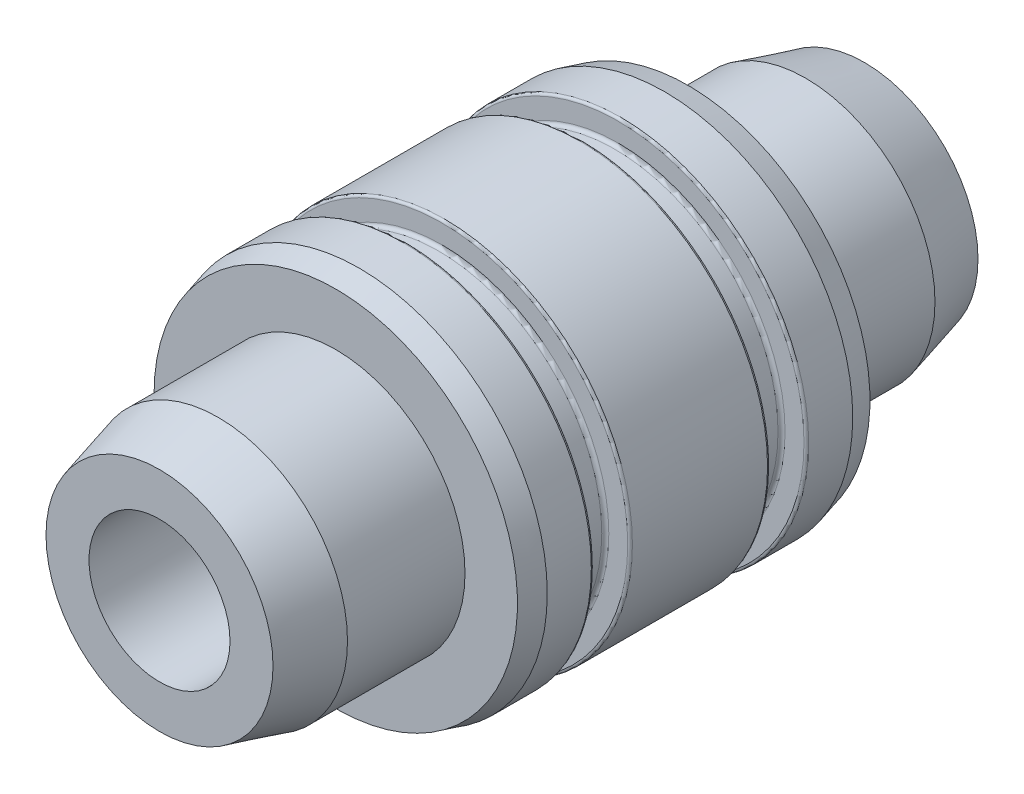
SolidWorks part; units mm, degrees
ref_plane "Face" through (0, 0, 0) normal (0, 0, 1) x (1, 0, 0)
ref_plane "Dessus" through (0, 0, 0) normal (0, 1, 0) x (1, 0, 0)
ref_plane "Profil" through (0, 0, 0) normal (1, 0, 0) x (0, 0, -1)
sketch "Esquisse1" plane through (0, 0, 0) normal (0, 0, 1) x (1, 0, 0)
  circle A0 centre (0, 0) radius 16
  dimension "D1" = 32
extrude "Extrusion1" add sketch "Esquisse1" along normal blind 15
sketch "Esquisse3" plane through (0, 0, 15) normal (0, 0, 1) x (1, 0, 0)
  circle A0 centre (0, 0) radius 11
  dimension "D1" = 22
extrude "Extrusion2" add sketch "Esquisse3" along normal blind 15
sketch "Esquisse4" plane through (0, 0, 30) normal (0, 0, 1) x (1, 0, 0)
  circle A0 centre (0, 0) radius 6
  dimension "D1" = 12
extrude "Enlèv. mat.-Extru.1" cut sketch "Esquisse4" against normal up to surface (15 mm away)
chamfer "Chanfrein1" distance 5 angle 15 1 edges at (11, 0, 30)
chamfer "Chanfrein2" distance 2 angle 15 1 edges at (16, 0, 15)
mirror "Symétrie5" about plane through (0, 0, 0) normal (0, 0, 1)
hole_wizard "Diamètre du perçage M8.0 (8.000000)1" positions "Esquisse3D1" profile "Esquisse5" hole size "M8.0" standard "ISO"
sketch3d "Esquisse3D1"
  circle A0 centre (0, 0, 30) radius 6 construction
  point P0 (0, 0, 15)
  point P8 (0, 0, 36)
sketch "Esquisse5" plane through (0, 0, 15) normal (1, 0, 0) x (0, -1, 0)
  line L0 (0, 0) -> (0, 45)
  line L1 (0, 45) -> (4, 45)
  line L2 (4, 45) -> (4, 0)
  line L5 (4, 0) -> (0, 0)
  line L11 (0, -6.35) -> (0, 107.95) construction
  dimension "Diamètre du perçage jusqu'au prochain" = 8
  dimension "Profondeur du perçage jusqu'au prochain" = 45
sketch "Esquisse7" plane through (0, 0, 0) normal (1, 0, 0) x (0, 0, -1)
  line L0 (-16.1437, 0) -> (16.7127, 0) construction
  line L1 (13, 16) -> (-13, 16) construction
  line L2 (-9.05, 16) -> (-5.95, 16)
  line L3 (-9.05, 16) -> (-9.05, 14.19)
  line L4 (-8.75, 13.89) -> (-6.25, 13.89)
  line L5 (-5.95, 16) -> (-5.95, 14.19)
  arc A0 (-9.05, 14.19) -> (-8.75, 13.89) centre (-8.75, 14.19) ccw
  arc A1 (-6.25, 13.89) -> (-5.95, 14.19) centre (-6.25, 14.19) ccw
  point P9 (-7.5, 13.89)
  dimension "D4" = 0.3
  dimension "D1" = 27.78
  dimension "D2" = 3.1
  dimension "D3" = 7.5
revolve "Enlèvement de matière-Révolution1" cut sketch "Esquisse7" angle 360 about L0
fillet "Congé1" radius 0.2 2 edges at (16, 0, 9.05) (16, 0, 5.95)
pattern_linear "Répétition linéaire1" count 2 spacing 15 along (0, 0, -1) of "Enlèvement de matière-Révolution1", "Congé1"
